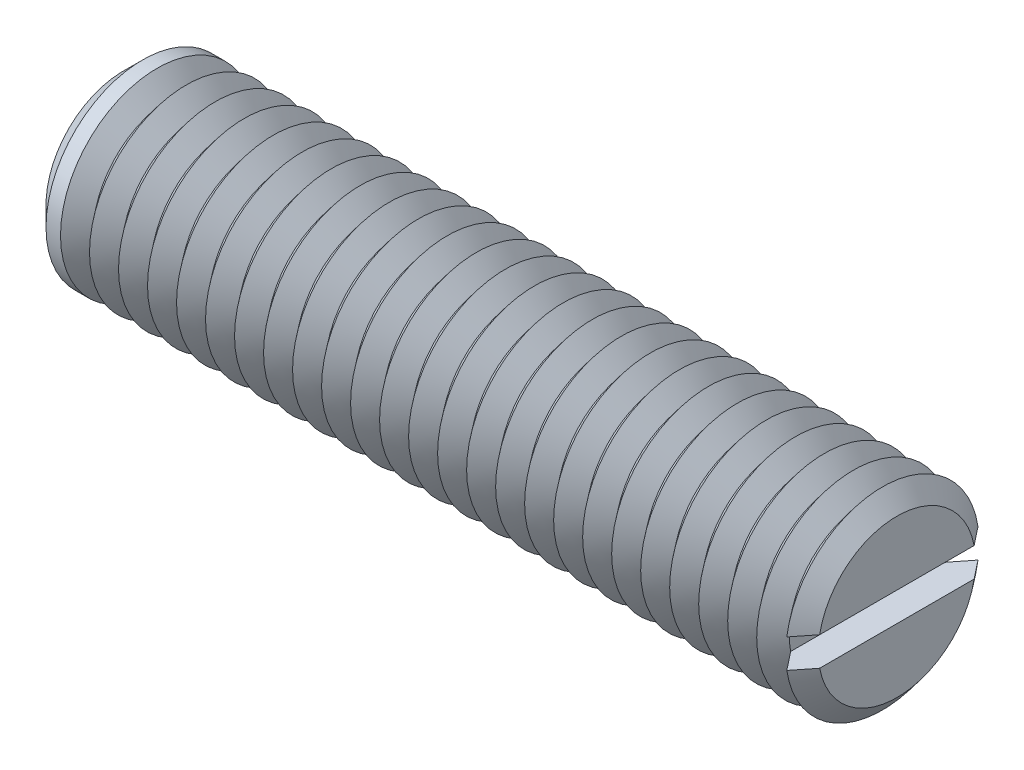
SolidWorks part; units mm, degrees
ref_plane "Front Plane" through (0, 0, 0) normal (0, 0, 1) x (1, 0, 0)
ref_plane "Top Plane" through (0, 0, 0) normal (0, 1, 0) x (1, 0, 0)
ref_plane "Right Plane" through (0, 0, 0) normal (1, 0, 0) x (0, 0, -1)
sketch "Sketch1" plane through (0, 0, 0) normal (1, 0, 0) x (0, 0, -1)
  circle A0 centre (0, 0) radius 5
  dimension "D1" = 10
extrude "Extrude1" add sketch "Sketch1" along normal mid plane 40
sketch "Sketch2" plane through (0, 0, 0) normal (0, 0, 1) x (1, 0, 0)
  line L0 (20, 0.75) -> (18.5, 0.75)
  line L1 (20, -5) -> (20, 5) construction
  line L2 (18.5, 0.75) -> (18.5, -0.75)
  line L3 (0, 0) -> (50000, 0) construction
  line L4 (20, -0.75) -> (18.5, -0.75)
  line L5 (20, -0.75) -> (20, 0.75)
  point P9 (18.5, 0)
  dimension "D1" = 1.5
extrude "Extrude2" cut sketch "Sketch2" against normal mid plane 15
chamfer "Chamfer1" distance 1 angle 45 1 edges at (-20, 0, -5)
sketch "Sketch3" plane through (0, 0, 0) normal (0, 0, 1) x (1, 0, 0)
  line L0 (0, 0) -> (30.9602, 0) construction
  line L1 (19.25, -5) -> (20.75, -5)
  line L2 (-19, -5) -> (20, -5) construction
  line L3 (20.75, -5) -> (20, -4.0633)
  line L4 (20, -5) -> (20, -0.75) construction
  line L5 (20, -4.0633) -> (19.25, -5)
  dimension "D1" = 1.5
  dimension "D2" = 1.2
revolve "Cut-Revolve1" cut sketch "Sketch3" angle 360 about L0
pattern_linear "LPattern1" count 26 spacing 1.5 along (-1, 0, 0) of "Cut-Revolve1"
equation "\"D2@Sketch3\" = \"D1@Sketch3\"*0.8"
